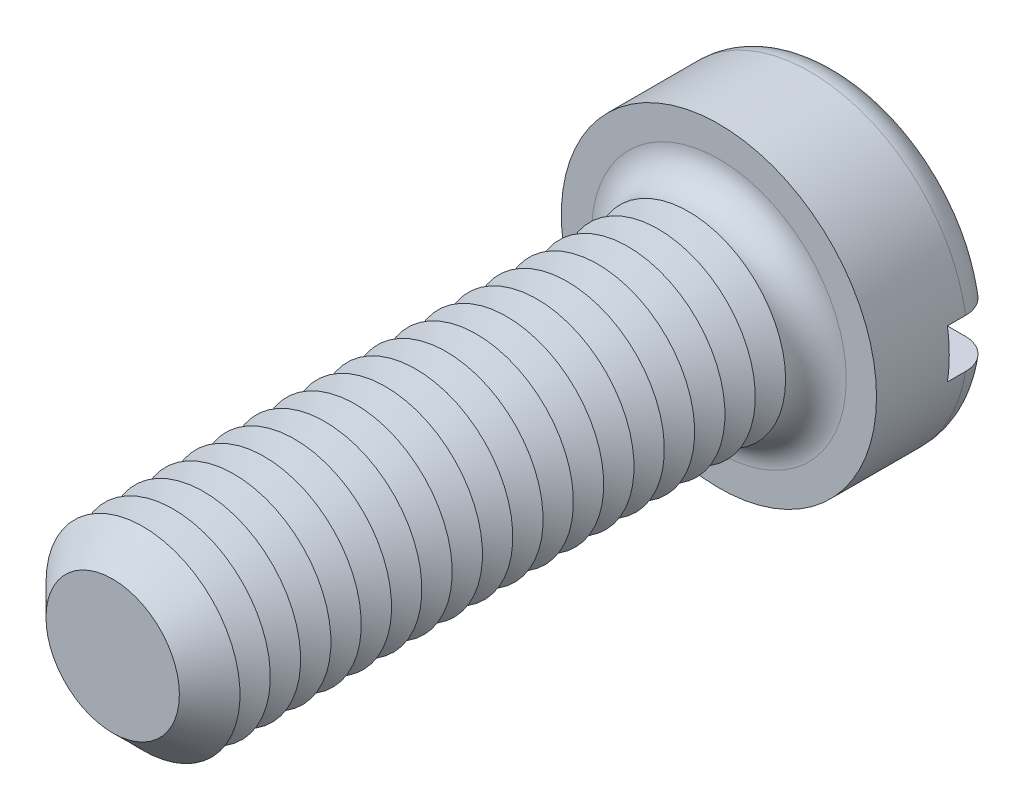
SolidWorks part; units mm, degrees
ref_plane "Front Plane" through (0, 0, 0) normal (0, 0, 1) x (1, 0, 0)
ref_plane "Top Plane" through (0, 0, 0) normal (0, 1, 0) x (1, 0, 0)
ref_plane "Right Plane" through (0, 0, 0) normal (1, 0, 0) x (0, 0, -1)
sketch "Sketch3" plane through (0, 0, 0) normal (0, 0, 1) x (1, 0, 0)
  circle A0 centre (0, 0) radius 6.5
  dimension "D1" = 13
extrude "Boss-Extrude2" add sketch "Sketch3" against normal blind 5
sketch "Sketch4" plane through (0, 0, 0) normal (0, 0, 1) x (1, 0, 0)
  circle A0 centre (0, 0) radius 4
  dimension "D1" = 8
extrude "Boss-Extrude3" add sketch "Sketch4" along normal blind 25
fillet "Fillet1" radius 1.25 2 edges at (6.5, 0, -5) (4, 0, 0)
chamfer "Chamfer1" distance 1.25 angle 45 1 edges at (4, 0, 25)
sketch "Sketch5" plane through (0, 0, 0) normal (1, 0, 0) x (0, 0, -1)
  line L0 (1.6944, 0) -> (-7.6738, 0) construction
sketch "Sketch6" plane through (0, 0, 0) normal (1, 0, 0) x (0, 0, -1)
  line L0 (-1.25, 4) -> (-1.875, 2.9175)
  line L1 (-1.875, 2.9175) -> (-2.5, 4)
  line L2 (-1.25, 4) -> (-23.75, 4) construction
  line L3 (-2.5, 4) -> (-1.25, 4)
  dimension "D1" = 1.25
revolve "Cut-Revolve1" cut sketch "Sketch6" angle 360 about L0
pattern_linear "LPattern1" count 18 spacing 1.25 along (0, 0, 1) of "Cut-Revolve1"
sketch "Sketch8" plane through (0, 0, -5) normal (0, 0, -1) x (-1, 0, 0)
  line L1 (6.5, -1) -> (-6.5, -1)
  line L2 (6.5, -1) -> (6.5, 1)
  line L3 (6.5, 1) -> (-6.5, 1)
  line L4 (-6.5, -1) -> (-6.5, 1)
  line L5 (6.5, -1) -> (-6.5, 1) construction
  line L6 (6.5, 1) -> (-6.5, -1) construction
  point P0 (0, 0)
  dimension "D1" = 13
  dimension "D2" = 2
extrude "Cut-Extrude1" cut sketch "Sketch8" against normal blind 2
